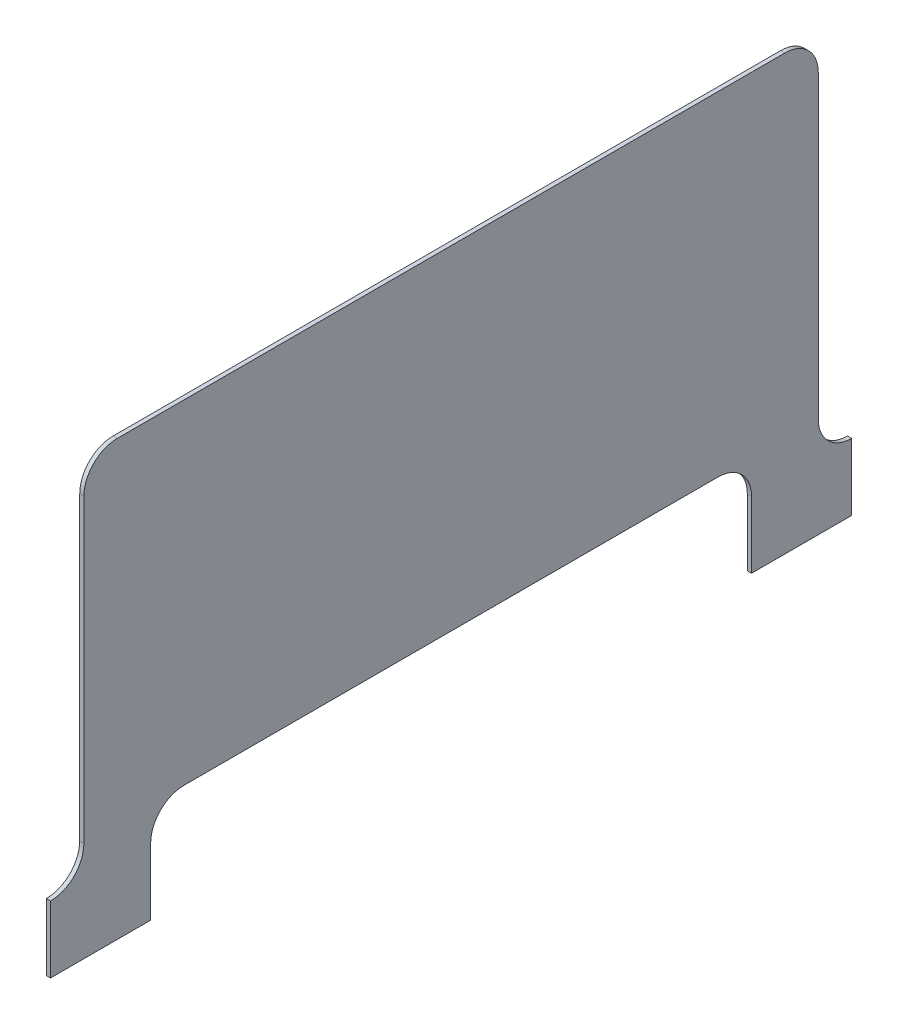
SolidWorks part; units mm, degrees
ref_plane "Front Plane" through (0, 0, 0) normal (0, 0, 1) x (1, 0, 0)
ref_plane "Top Plane" through (0, 0, 0) normal (0, 1, 0) x (1, 0, 0)
ref_plane "Right Plane" through (0, 0, 0) normal (1, 0, 0) x (0, 0, -1)
sketch "Sketch1" plane through (0, 0, 0) normal (0, 0, 1) x (1, 0, 0)
  line L1 (-79.375, 330.2) -> (-76.2, 330.2)
  line L2 (-79.375, 330.2) -> (-79.375, 0)
  line L3 (-79.375, 0) -> (-76.2, 0)
  line L4 (-76.2, 330.2) -> (-76.2, 0)
  dimension "D1" = 330.2
  dimension "D2" = 3.175
  dimension "D3" = 76.2
extrude "Extrude1" add sketch "Sketch1" along normal mid plane 609.6
sketch "Sketch2" plane through (-79.375, 0, 0) normal (-1, 0, 0) x (0, 0, 1)
  line L0 (0, 0) -> (0, 267.484) construction
  line L1 (279.4, 330.2) -> (279.4, 76.2)
  line L2 (304.8, 330.2) -> (-304.8, 330.2) construction
  line L3 (304.8, 330.2) -> (304.8, 0) construction
  line L4 (304.8, 0) -> (-304.8, 0) construction
  line L5 (-279.4, 330.2) -> (-279.4, 76.2)
  line L6 (304.8, 50.8) -> (304.8, 330.2)
  line L7 (304.8, 330.2) -> (279.4, 330.2)
  line L8 (-304.8, 50.8) -> (-304.8, 330.2)
  line L9 (-304.8, 330.2) -> (-279.4, 330.2)
  arc A0 (279.4, 76.2) -> (304.8, 50.8) centre (304.8, 76.2) ccw
  arc A1 (-279.4, 76.2) -> (-304.8, 50.8) centre (-304.8, 76.2) cw
  dimension "D1" = 25.4
  dimension "D2" = 50.8
extrude "Cut-Extrude1" cut sketch "Sketch2" against normal through all
sketch "Sketch3" plane through (-79.375, 0, 0) normal (-1, 0, 0) x (0, 0, 1)
  line L0 (304.8, 0) -> (-304.8, 0) construction
  line L1 (-228.6, 0) -> (228.6, 0)
  line L2 (-228.6, 0) -> (-228.6, 76.2)
  line L3 (-228.6, 76.2) -> (228.6, 76.2)
  line L4 (228.6, 0) -> (228.6, 76.2)
  line L5 (0, 76.2) -> (0, 0) construction
  dimension "D1" = 457.2
  dimension "D2" = 76.2
extrude "Cut-Extrude2" cut sketch "Sketch3" against normal through all
fillet "Fillet1" radius 25.4 4 edges at (-77.7875, 76.2, 228.6) (-77.7875, 76.2, -228.6) (-77.7875, 330.2, -279.4) (-77.7875, 330.2, 279.4)
